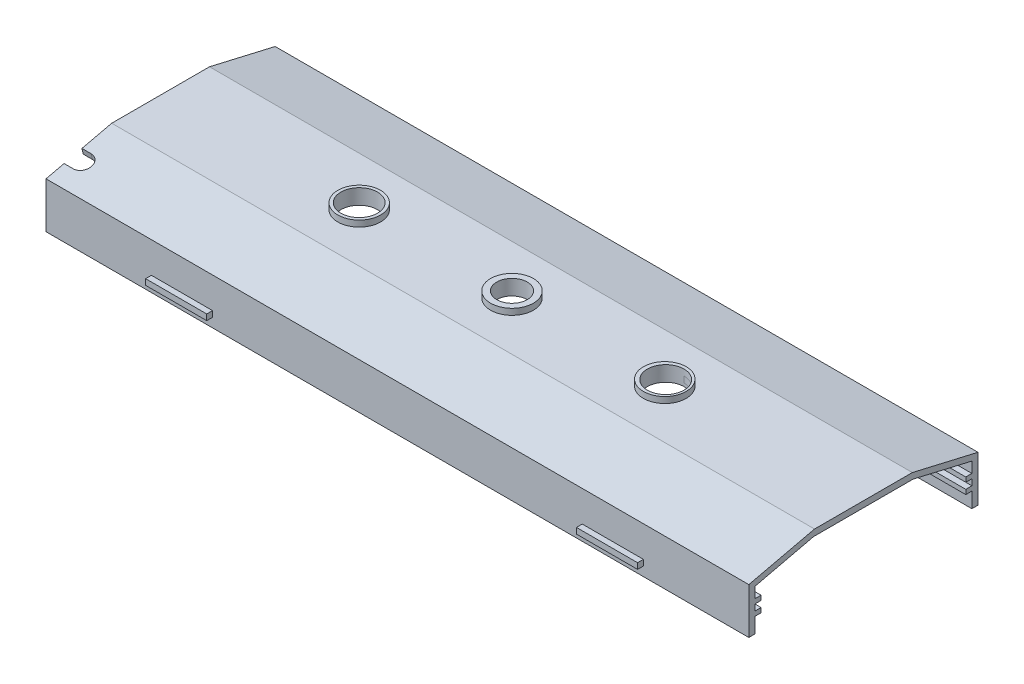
SolidWorks part; units mm, degrees
ref_plane "Plan de face" through (0, 0, 0) normal (0, 0, 1) x (1, 0, 0)
ref_plane "Plan de dessus" through (0, 0, 0) normal (0, 1, 0) x (1, 0, 0)
ref_plane "Plan de droite" through (0, 0, 0) normal (1, 0, 0) x (0, 0, -1)
sketch "Esquisse1" plane through (0, 0, 0) normal (1, 0, 0) x (0, 0, -1)
  line L0 (-37.5, 0) -> (25.7942, 0) construction
  line L1 (0, 0) -> (0, 24.3612) construction
  line L2 (16, 20) -> (-16, 20)
  line L3 (-16, 20) -> (-37.5, 15)
  line L4 (-37.5, 15) -> (-37.5, 0)
  line L5 (-37.5, 0) -> (-35.5, 0)
  line L6 (-35.5, 0) -> (-35.5, 5)
  line L7 (-35.5, 5) -> (-33.5, 5)
  line L8 (-33.5, 5) -> (-33.5, 6.5)
  line L9 (-33.5, 6.5) -> (-35.5, 6.5)
  line L10 (-35.5, 6.5) -> (-35.5, 8.5)
  line L11 (-35.5, 8.5) -> (-33.5, 8.5)
  line L12 (-33.5, 8.5) -> (-33.5, 10)
  line L13 (-33.5, 10) -> (-35.5, 10)
  line L14 (-35.5, 10) -> (-35.5, 13.5)
  line L15 (35.5, 13.5) -> (16.3, 18)
  line L16 (-35.5, 13.5) -> (-16.3, 18)
  line L17 (-16.3, 18) -> (16.3, 18)
  line L18 (16, 20) -> (37.5, 15)
  line L19 (37.5, 15) -> (37.5, 0)
  line L20 (35.5, 10) -> (35.5, 13.5)
  line L21 (33.5, 10) -> (35.5, 10)
  line L22 (33.5, 8.5) -> (33.5, 10)
  line L23 (35.5, 8.5) -> (33.5, 8.5)
  line L24 (35.5, 6.5) -> (35.5, 8.5)
  line L25 (33.5, 6.5) -> (35.5, 6.5)
  line L26 (33.5, 5) -> (33.5, 6.5)
  line L27 (35.5, 5) -> (33.5, 5)
  line L28 (37.5, 0) -> (35.5, 0)
  line L29 (35.5, 0) -> (35.5, 5)
  point P19 (0, 18)
  point P22 (0, 20)
  dimension "D1" = 20
  dimension "D2" = 15
  dimension "D3" = 2
  dimension "D4" = 5
  dimension "D5" = 2
  dimension "D6" = 1.5
  dimension "D7" = 2
  dimension "D8" = 2
  dimension "D9" = 2
  dimension "D10" = 1.5
  dimension "D11" = 2
  dimension "D13" = 16
  dimension "D14" = 3.5
  dimension "D15" = 2
  dimension "D16" = 16.3
  dimension "D17" = 19.2
extrude "Extrusion1" add sketch "Esquisse1" along normal blind 230
sketch "Esquisse2" plane through (0, 20, 0) normal (0, 1, 0) x (-1, 0, 0)
  line L0 (-230, -16) -> (-230, 16) construction
  line L1 (-230, 37.5) -> (0, 37.5) construction
  circle A0 centre (-165, 0) radius 7
  dimension "D1" = 14
  dimension "D2" = 65
  dimension "D3" = 37.5
extrude "Extrusion2" add sketch "Esquisse2" along normal blind 2
sketch "Esquisse3" plane through (0, 20, 0) normal (0, 1, 0) x (-1, 0, 0)
  line L0 (-115, -80.0436) -> (-115, 65.1852) construction
  line L1 (-230, 35.5) -> (-230, 16.3) construction
  circle A1 centre (-165.3268, 0) radius 6
  point P2 (-230, 25.9)
  dimension "D2" = 12
  dimension "D1" = 115
extrude "Enlèv. mat.-Extru.1" cut sketch "Esquisse3" against normal through all
sketch "Esquisse4" plane through (0, 18, 0) normal (0, -1, 0) x (1, 0, 0)
  circle A0 centre (165.9074, 0) radius 8
  dimension "D1" = 16
extrude "Extrusion3" add sketch "Esquisse4" along normal blind 1
sketch "Esquisse5" plane through (0, 22, 0) normal (0, 1, 0) x (-1, 0, 0)
  circle A0 centre (-165.3023, 0) radius 6
  dimension "D1" = 12
extrude "Enlèv. mat.-Extru.2" cut sketch "Esquisse5" against normal through all
sketch "Esquisse6" plane through (0, 20, 0) normal (0, 1, 0) x (-1, 0, 0)
  line L0 (0, -16) -> (0, 16) construction
  circle A0 centre (-65, 0) radius 7
  dimension "D1" = 14
  dimension "D2" = 65
extrude "Extrusion4" add sketch "Esquisse6" along normal blind 2
sketch "Esquisse7" plane through (0, 18, 0) normal (0, -1, 0) x (1, 0, 0)
  line L0 (0, 16.3) -> (0, -16.3) construction
  circle A0 centre (65, 0) radius 8
  dimension "D1" = 16
  dimension "D2" = 65
extrude "Extrusion5" add sketch "Esquisse7" along normal blind 1
sketch "Esquisse8" plane through (0, 17, 0) normal (0, -1, 0) x (1, 0, 0)
  line L0 (0, 16.3) -> (0, -16.3) construction
  circle A0 centre (65, 0) radius 6
  dimension "D1" = 12
  dimension "D2" = 65
extrude "Enlèv. mat.-Extru.3" cut sketch "Esquisse8" against normal through all
sketch "Esquisse9" plane through (0, 20, 0) normal (0, 1, 0) x (-1, 0, 0)
  line L0 (-230, -16) -> (-230, 16) construction
  circle A0 centre (-115, 0) radius 7
  dimension "D1" = 14
  dimension "D2" = 115
extrude "Extrusion6" add sketch "Esquisse9" along normal blind 2
sketch "Esquisse10" plane through (0, 18, 0) normal (0, -1, 0) x (1, 0, 0)
  line L0 (230, 16.3) -> (230, -16.3) construction
  circle A0 centre (115, 0) radius 8
  dimension "D1" = 16
  dimension "D2" = 115
extrude "Extrusion7" add sketch "Esquisse10" along normal blind 1
sketch "Esquisse11" plane through (0, 17, 0) normal (0, -1, 0) x (1, 0, 0)
  circle A0 centre (115, 0) radius 5
  dimension "D1" = 10
  dimension "D2" = 115
extrude "Enlèv. mat.-Extru.4" cut sketch "Esquisse11" against normal through all
sketch "Esquisse12" plane through (0, 22.5038, 5.2335) normal (0, 0.974, 0.2265) x (-1, 0, 0)
  line L0 (0, 21.0539) -> (-3, 21.0539)
  line L1 (0, 11.0539) -> (0, 33.1276) construction
  line L2 (0, 27.0539) -> (-3, 27.0539)
  line L3 (-230, 11.0539) -> (0, 11.0539) construction
  arc A0 (-3, 21.0539) -> (-3, 27.0539) centre (-3, 24.0539) cw
  dimension "D1" = 3
  dimension "D2" = 6
  dimension "D3" = 10
extrude "Enlèv. mat.-Extru.5" cut sketch "Esquisse12" against normal through all and the other way through all
sketch "Esquisse13" plane through (0, 0, 37.5) normal (0, 0, 1) x (1, 0, 0)
  line L1 (230, 0) -> (0, 0) construction
  line L2 (34.5, 4.9) -> (54.5, 4.9)
  line L3 (34.5, 4.9) -> (34.5, 3)
  line L4 (34.5, 3) -> (54.5, 3)
  line L6 (54.5, 4.9) -> (54.5, 3)
  line L7 (0, 15) -> (0, 0) construction
  dimension "D1" = 20
  dimension "D2" = 1.9
  dimension "D3" = 3
  dimension "D4" = 34.5
extrude "Extrusion8" add sketch "Esquisse13" along normal blind 1.9
sketch "Esquisse14" plane through (0, 0, 37.5) normal (0, 0, 1) x (1, 0, 0)
  line L0 (230, 0) -> (0, 0) construction
  line L1 (175.5, 4.9) -> (195.5, 4.9)
  line L2 (175.5, 4.9) -> (175.5, 3)
  line L3 (175.5, 3) -> (195.5, 3)
  line L4 (195.5, 4.9) -> (195.5, 3)
  dimension "D1" = 20
  dimension "D2" = 1.9
  dimension "D3" = 3
  dimension "D4" = 34.5
extrude "Extrusion9" add sketch "Esquisse14" along normal blind 1.9
sketch "Esquisse15" plane through (0, 0, -37.5) normal (0, 0, -1) x (-1, 0, 0)
  line L0 (-230, 0) -> (0, 0) construction
  line L1 (-195.5, 4.9) -> (-175.5, 4.9)
  line L2 (-195.5, 4.9) -> (-195.5, 3)
  line L3 (-195.5, 3) -> (-175.5, 3)
  line L4 (-175.5, 4.9) -> (-175.5, 3)
  line L5 (-230, 0) -> (-230, 15) construction
  dimension "D1" = 20
  dimension "D2" = 1.9
  dimension "D3" = 3
  dimension "D4" = 34.5
extrude "Extrusion10" add sketch "Esquisse15" along normal blind 1.9
sketch "Esquisse16" plane through (0, 0, -37.5) normal (0, 0, -1) x (-1, 0, 0)
  line L0 (-230, 0) -> (0, 0) construction
  line L1 (-54.5, 4.9) -> (-34.5, 4.9)
  line L2 (-54.5, 4.9) -> (-54.5, 3)
  line L3 (-54.5, 3) -> (-34.5, 3)
  line L4 (-34.5, 4.9) -> (-34.5, 3)
  line L5 (0, 0) -> (0, 15) construction
  dimension "D1" = 1.9
  dimension "D2" = 3
  dimension "D3" = 20
  dimension "D4" = 34.5
extrude "Extrusion11" add sketch "Esquisse16" along normal blind 1.9
